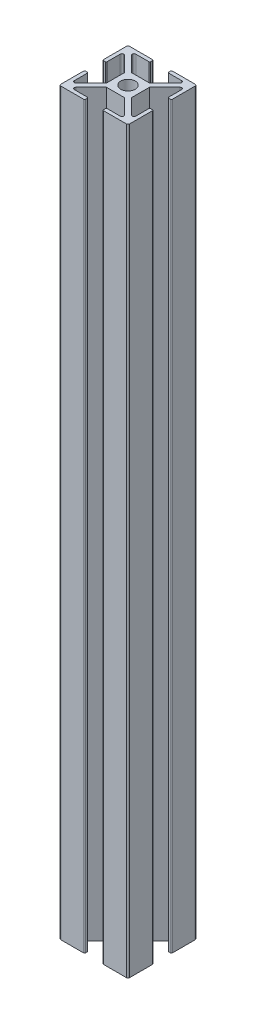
SolidWorks part; units mm, degrees
ref_plane "Front Plane" through (0, 0, 0) normal (0, 0, 1) x (1, 0, 0)
ref_plane "Top Plane" through (0, 0, 0) normal (0, 1, 0) x (1, 0, 0)
ref_plane "Right Plane" through (0, 0, 0) normal (1, 0, 0) x (0, 0, -1)
sketch "Sketch2" plane through (0, 0, 0) normal (0, 1, 0) x (1, 0, 0)
  line L12 (-10, -8.9393) -> (8.9393, 10)
  line L13 (-3.66, -3.66) -> (3.66, -3.66)
  line L26 (-3.66, -3.66) -> (-3.66, 3.66)
  line L27 (-3.66, 3.66) -> (3.66, 3.66)
  line L32 (3.66, -3.66) -> (3.66, 3.66)
  line L37 (-3.66, -3.66) -> (3.66, 3.66) construction
  line L50 (-3.66, 3.66) -> (3.66, -3.66) construction
  line L51 (-10, -8.9393) -> (-8.9393, -10)
  line L52 (8.9393, 10) -> (10, 8.9393)
  line L53 (-8.9393, -10) -> (10, 8.9393)
  line L54 (-10, -8.9393) -> (10, 8.9393) construction
  line L55 (8.9393, 10) -> (-8.9393, -10) construction
  line L56 (0, 0) -> (0, 25.4805) construction
  line L57 (10, 8.9393) -> (2.63, 8.9393)
  line L58 (-10, -8.9393) -> (-10, -10)
  line L59 (-10, -10) -> (-8.9393, -10)
  line L60 (10, 8.9393) -> (10, 10)
  line L61 (10, 10) -> (2.63, 10)
  line L62 (2.63, 8.9393) -> (2.63, 10)
  line L63 (5.995, 7.0557) -> (5.995, 8.9393)
  line L64 (10, 10) -> (10, 2.63)
  line L65 (8.9393, 10) -> (10, 10)
  line L66 (8.9393, 2.63) -> (10, 2.63)
  line L67 (8.9393, 10) -> (8.9393, 2.63)
  circle A0 centre (0, 0) radius 2.095
  point P0 (0, 0)
  dimension "D3" = 4.19
  dimension "D1" = 7.32
  dimension "D2" = 7.32
  dimension "D4" = 20
  dimension "D5" = 1.5
  dimension "D6" = 2.63
  dimension "D8" = 5.995
  dimension "D7" = 90
extrude "Boss-Extrude1" add sketch "Sketch2" along normal blind 215 contours L53 L67 L66 L64 | L67 L57 L12 L27 L32 L53 | L67 L12 L57 | L52 L67 L57 | L60 L61 L52 | L57 L67 L53 | L62 L57 L12 L61 | A0 L53 L32 L27 L12 | A0 L53 L13 L32 | A0 L12 L27 L26 | A0 L12 L26 L13 L53
fillet "Fillet1" radius 0.5 3 edges at (7.8787, 107.5, -8.9393) (8.9393, 107.5, -7.8787) (10, 107.5, -10)
fillet "Fillet2" radius 0.25 4 edges at (2.63, 107.5, -10) (2.63, 107.5, -8.9393) (8.9393, 107.5, -2.63) (10, 107.5, -2.63)
pattern_circular "CirPattern1" count 4 over 360 about axis through (0, 0, 0) along (0, 1, 0) of "Boss-Extrude1", "Fillet2", "Fillet1"
sketch "Sketch3" plane through (10, 0, 0) normal (1, 0, 0) x (0, 0, -1)
  line L0 (2.5025, 205.75) -> (2.5025, 200.75) construction
  line L1 (-2.4975, 205.75) -> (-2.4975, 200.75) construction
  line L4 (2.5025, 205.75) -> (2.5025, 200.75)
  line L5 (-2.4975, 205.75) -> (-2.4975, 200.75)
  line L8 (2.5025, 9.25) -> (2.5025, 14.25) construction
  line L13 (-2.4975, 9.25) -> (-2.4975, 14.25) construction
  line L14 (2.5025, 9.25) -> (2.5025, 14.25)
  line L15 (-2.4975, 9.25) -> (-2.4975, 14.25)
  arc A0 (-2.4975, 200.75) -> (2.5025, 200.75) centre (0.0025, 200.75) ccw construction
  arc A1 (2.5025, 205.75) -> (-2.4975, 205.75) centre (0.0025, 205.75) ccw construction
  arc A4 (-2.4975, 200.75) -> (2.5025, 200.75) centre (0.0025, 200.75) ccw
  arc A5 (2.5025, 205.75) -> (-2.4975, 205.75) centre (0.0025, 205.75) ccw
  arc A8 (2.5025, 14.25) -> (-2.4975, 14.25) centre (0.0025, 14.25) ccw construction
  arc A11 (-2.4975, 9.25) -> (2.5025, 9.25) centre (0.0025, 9.25) ccw construction
  arc A12 (2.5025, 14.25) -> (-2.4975, 14.25) centre (0.0025, 14.25) ccw
  arc A13 (-2.4975, 9.25) -> (2.5025, 9.25) centre (0.0025, 9.25) ccw
extrude "Cut-Extrude1" cut sketch "Sketch3" against normal through all
